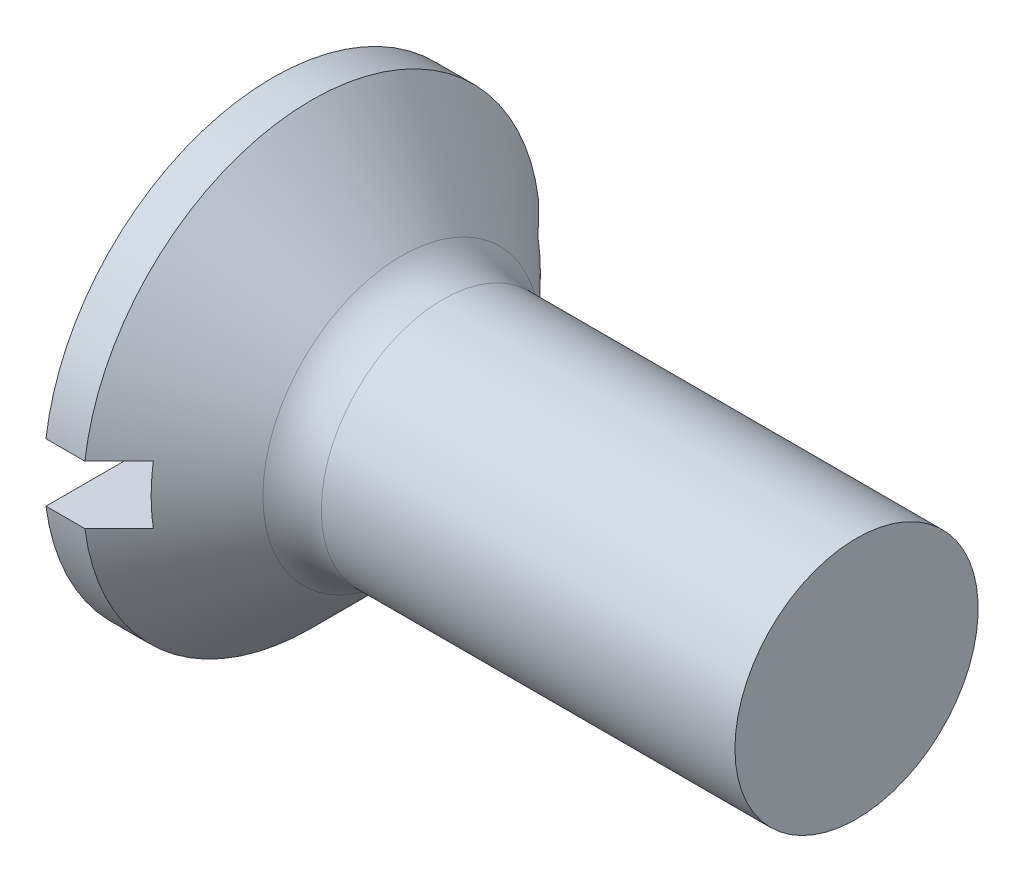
SolidWorks part; units mm, degrees
ref_plane "Plane1" through (0, 0, 0) normal (0, 0, 1) x (1, 0, 0)
ref_plane "Plane2" through (0, 0, 0) normal (0, 1, 0) x (1, 0, 0)
ref_plane "Plane3" through (0, 0, 0) normal (1, 0, 0) x (0, 0, -1)
revolve "Base-Revolve" add sketch "BodySke" angle 360 about L5
sketch "BodySke" plane through (0, 0, 0) normal (0, 0, 1) x (1, 0, 0)
  line L0 (0, 0) -> (0, 2.35)
  line L1 (0, 2.35) -> (0.4, 2.35)
  line L2 (1.5, 1.25) -> (6, 1.25)
  line L3 (6, 1.25) -> (6, 0)
  line L4 (6, 0) -> (0, 0)
  line L5 (-6.35, 0) -> (82.55, 0) construction
  line L6 (1.5, -1.25) -> (6, -1.25) construction
  line L7 (0.4, -2.35) -> (1.5, -1.25) construction
  line L8 (0.4, 2.35) -> (1.5, 1.25)
  line L9 (0, -2.35) -> (0.4, -2.35) construction
  line L10 (1.95, 2.8375) -> (1.95, -6.6875) construction
  line L11 (0, 6.35) -> (0, -3.175) construction
  dimension "Diameter" = 2.5
  dimension "Length" = 6
  dimension "Head_ht" = 1.5
  dimension "Head_dia" = 4.7
  dimension "Head_ang" = 90
  dimension "D6" = 0.4
  dimension "Advance" = 0.45
  dimension "Thread_nom" = 6
extrude "Slot" cut sketch "Sketch2" against normal blind 0.75
sketch "Sketch2" plane through (0, 0, 0) normal (-1, 0, 0) x (0, 0, 1)
  line L0 (-2.35, -0.3) -> (2.35, -0.3)
  line L1 (-2.35, -0.3) -> (-2.35, 0.3)
  line L2 (2.35, 0.3) -> (-2.35, 0.3)
  line L3 (2.35, 0.3) -> (2.35, -0.3)
  dimension "D1" = 0.3
  dimension "Slot_width" = 0.6
  dimension "D2" = 4.7
  dimension "D3" = 2.35
fillet "Fillet1" radius 0.6 1 edges at (1.5, 0, 1.25)
sketch "ThdSchSke" plane through (0, 0, 0) normal (0, 0, 1) x (1, 0, 0)
  line L0 (1.95, -0.9965) -> (1.7725, -1.25)
  line L1 (1.95, -0.9965) -> (2.1275, -1.25)
  line L2 (2.1275, -1.25) -> (2.1275, -1.5625)
  line L3 (-3.175, 0) -> (5.1513, 0) construction
  line L5 (2.1275, -1.5625) -> (1.7725, -1.5625)
  line L6 (1.7725, -1.5625) -> (1.7725, -1.25)
  line L7 (0, 2.35) -> (0, 0.3) construction
  dimension "Thread_minor" = 1.993
  dimension "Diameter" = 2.5
  dimension "Start" = 1.95
  dimension "SideAngle" = 55
  dimension "VeeAngle" = 70
  dimension "Overcut" = 3.125
revolve "ThreadSchematic" cut sketch "ThdSchSke" angle 360 about L3
pattern_linear "ThdSchPat"
equation "\"D1@Sketch2\" = \"Slot_width@Sketch2\" / 2"
equation "\"D2@Sketch2\" = \"Head_dia@BodySke\""
equation "\"D3@Sketch2\" = \"D2@Sketch2\" / 2"
equation "\"Thread_length@ThreadCosmetic\" = ((sgn( (\"Length@BodySke\" - \"Advance@BodySke\" * 1.0 - \"Head_ht@BodySke\" ) - \"Thread_nom@BodySke\" )-1)*( (\"Length@BodySke\" - \"Advance@BodySke\" * 1.0 - \"Head_ht@BodySke\" "
equation "\"Thread_minor@ThdSchSke\" = \"Thread_minor@ThreadCosmetic\""
equation "\"Diameter@ThdSchSke\" = \"Diameter@BodySke\""
equation "\"Overcut@ThdSchSke\" = \"Diameter@BodySke\" * 1.25"
equation "\"Start@ThdSchSke\" = 0.000001 + \"Length@BodySke\" - \"Thread_length@ThreadCosmetic\"  '---Countersunk---"
equation "\"Num_threads@ThdSchPat\" = int( \"Thread_length@ThreadCosmetic\" / \"Advance@BodySke\" + 0.999 )  + 1"
equation "\"Advance@ThdSchPat\" = \"Thread_length@ThreadCosmetic\" /  (\"Num_threads@ThdSchPat\" - 1) 'relax it"
